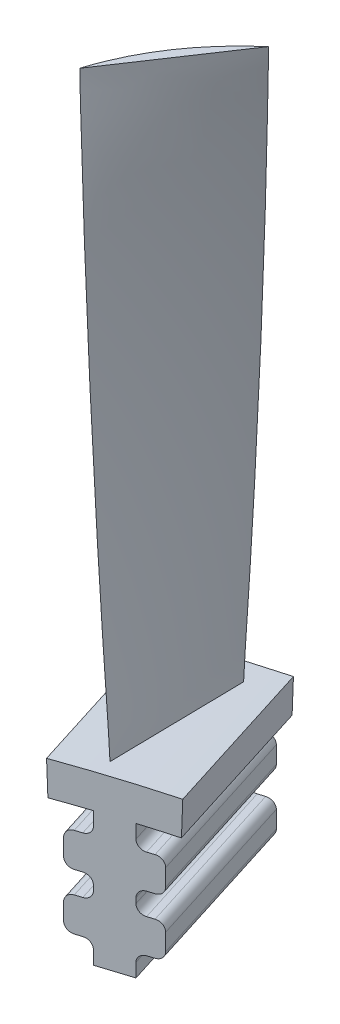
SolidWorks part; units mm, degrees
ref_plane "Front Plane" through (0, 0, 0) normal (0, 0, 1) x (1, 0, 0)
ref_plane "Top Plane" through (0, 0, 0) normal (0, 1, 0) x (1, 0, 0)
ref_plane "Right Plane" through (0, 0, 0) normal (1, 0, 0) x (0, 0, -1)
sketch "Sketch1" plane through (0, 0, 0) normal (0, 0, 1) x (1, 0, 0)
  line L0 (0, 510) -> (0, 498) construction
  line L1 (15.7054, 499.7533) -> (16.0195, 509.7483)
  line L2 (-15.7054, 499.7533) -> (-16.0195, 509.7483)
  line L3 (-5, 499.975) -> (-5, 495.975)
  line L4 (-7.5, 493.475) -> (-9.5, 493.475)
  line L5 (-12, 490.975) -> (-12, 485.975)
  line L6 (-9.5, 483.475) -> (-7.5, 483.475)
  line L7 (-5, 480.975) -> (-5, 479.475)
  line L8 (-7.5, 476.975) -> (-9.5, 476.975)
  line L9 (-12, 474.475) -> (-12, 469.475)
  line L10 (-9.5, 466.975) -> (-7.5, 466.975)
  line L11 (-5, 464.475) -> (-5, 462.975)
  line L12 (-2.5, 460.475) -> (2.5, 460.475)
  line L13 (5, 464.475) -> (5, 462.975)
  line L14 (9.5, 466.975) -> (7.5, 466.975)
  line L15 (12, 474.475) -> (12, 469.475)
  line L16 (7.5, 476.975) -> (9.5, 476.975)
  line L17 (5, 480.975) -> (5, 479.475)
  line L18 (9.5, 483.475) -> (7.5, 483.475)
  line L19 (12, 490.975) -> (12, 485.975)
  line L20 (7.5, 493.475) -> (9.5, 493.475)
  line L21 (5, 499.975) -> (5, 495.975)
  line L22 (5, 462.975) -> (5, 460.475)
  line L23 (5, 460.475) -> (2.5, 460.475)
  line L24 (-5, 462.975) -> (-5, 460.475)
  line L25 (-5, 460.475) -> (-2.5, 460.475)
  arc A0 (15.7054, 499.7533) -> (5, 499.975) centre (0, 0) ccw
  arc A1 (16.0195, 509.7483) -> (-16.0195, 509.7483) centre (0, 0) ccw
  arc A2 (-12, 469.475) -> (-9.5, 466.975) centre (-9.5, 469.475) ccw
  arc A4 (-5, 464.475) -> (-7.5, 466.975) centre (-7.5, 464.475) ccw
  arc A5 (-9.5, 476.975) -> (-12, 474.475) centre (-9.5, 474.475) ccw
  arc A6 (-5, 479.475) -> (-7.5, 476.975) centre (-7.5, 479.475) cw
  arc A7 (-7.5, 483.475) -> (-5, 480.975) centre (-7.5, 480.975) cw
  arc A8 (-12, 485.975) -> (-9.5, 483.475) centre (-9.5, 485.975) ccw
  arc A9 (-9.5, 493.475) -> (-12, 490.975) centre (-9.5, 490.975) ccw
  arc A10 (-5, 495.975) -> (-7.5, 493.475) centre (-7.5, 495.975) cw
  arc A12 (5, 464.475) -> (7.5, 466.975) centre (7.5, 464.475) cw
  arc A13 (12, 469.475) -> (9.5, 466.975) centre (9.5, 469.475) cw
  arc A14 (9.5, 476.975) -> (12, 474.475) centre (9.5, 474.475) cw
  arc A15 (5, 479.475) -> (7.5, 476.975) centre (7.5, 479.475) ccw
  arc A16 (7.5, 483.475) -> (5, 480.975) centre (7.5, 480.975) ccw
  arc A17 (12, 485.975) -> (9.5, 483.475) centre (9.5, 485.975) cw
  arc A18 (9.5, 493.475) -> (12, 490.975) centre (9.5, 490.975) cw
  arc A19 (5, 495.975) -> (7.5, 493.475) centre (7.5, 495.975) ccw
  arc A20 (-5, 499.975) -> (-15.7054, 499.7533) centre (0, 0) ccw
  point P21 (-12, 466.975)
  point P24 (-5, 460.475)
  point P27 (-5, 466.975)
  point P30 (-12, 476.975)
  point P33 (-5, 476.975)
  point P36 (-5, 483.475)
  point P39 (-12, 483.475)
  point P42 (-12, 493.475)
  point P45 (-5, 493.475)
  point P50 (0, 460.475)
  dimension "D1" = 1000
  dimension "D2" = 1020
  dimension "D7" = 7
  dimension "D12" = 2.5
  dimension "D3" = 1.8
  dimension "D4" = 1.8
  dimension "D5" = 6.5
  dimension "D6" = 5
  dimension "D8" = 10
  dimension "D9" = 6.5
  dimension "D10" = 10
  dimension "D11" = 6.5
extrude "Boss-Extrude2" add sketch "Sketch1" along normal blind 50
ref_plane "Plane1" through (0, 680, 0) normal (0, 1, 0) x (1, 0, 0)
sketch "Sketch2" plane through (0, 680, 0) normal (0, 1, 0) x (1, 0, 0)
  line L0 (-10.5466, -45.2546) -> (0.7861, -6.7367)
  spline S0 degree 2 poles (0.7861, -6.7367) (-10.5838, -25.1686) (-10.5466, -45.2546) knots 0 0 0 1 1 1
extrude "Boss-Extrude3" add sketch "Sketch2" against normal up to surface (170.1091 mm away)
other "Move Face1" parameters "D1"=7
other "Flex1" parameters "D0"=35, "D1"=0, "D2"=0
